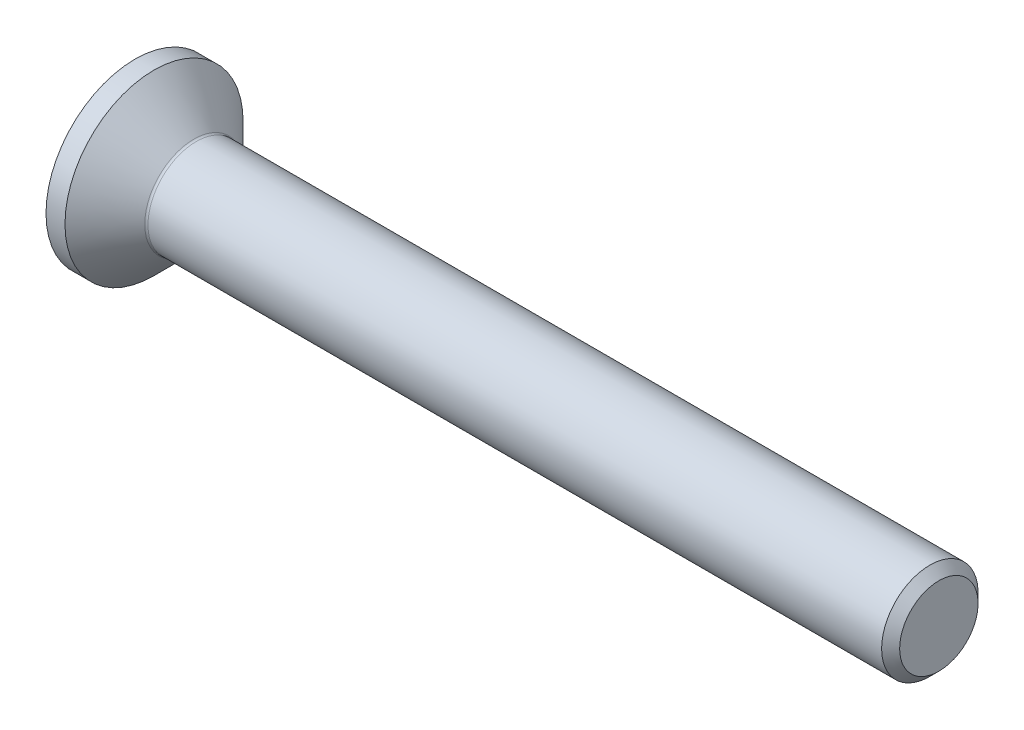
SolidWorks part; units mm, degrees
revolve "PreBroach" cut sketch "Sketch2"
sketch "Sketch2"
  line L0 (0, 1) -> (1.1, 1)
  line L1 (1.1, 1) -> (1.6774, 0)
  line L2 (0, 0) -> (127, 0) construction
  line L3 (1.6774, 0) -> (0, 0)
  line L4 (0, 0) -> (0, 1)
  line L5 (0, -1) -> (1.1, -1) construction
  line L6 (0, 0) -> (47.625, 0) construction
  line L8 (0, 2.77) -> (0, -2.77) construction
revolve "BaseBody" add sketch "BodySke"
sketch "BodySke" plane through (0, 0, 0) normal (0, 0, 1) x (1, 0, 0)
  line L0 (0, 0) -> (0, 2.77)
  line L1 (0.59, 2.77) -> (1.86, 1.5)
  line L2 (0, 2.77) -> (0.59, 2.77)
  line L3 (1.86, 1.5) -> (24.7195, 1.5)
  line L4 (25, 1.2195) -> (25, 0)
  line L5 (25, 0) -> (0, 0)
  line L6 (0, 0) -> (127, 0) construction
  line L7 (0.59, -2.77) -> (1.86, -1.5) construction
  line L8 (25, 1.2195) -> (24.7195, 1.5)
  line L9 (0, -2.77) -> (0.59, -2.77) construction
  line L10 (25, -1.2195) -> (24.7195, -1.5) construction
  line L11 (2.36, 7.85) -> (2.36, -14.375) construction
  line L12 (0, 19.05) -> (0, -3.175) construction
fillet "Fillet1" radius 0.1 1 edges at (1.86, 0, 1.5)
ref_plane "Plane1" through (0, 0, 0) normal (0, 0, 1) x (1, 0, 0)
ref_plane "Plane2" through (0, 0, 0) normal (0, 1, 0) x (1, 0, 0)
ref_plane "Plane3" through (0, 0, 0) normal (1, 0, 0) x (0, 0, -1)
other "Configuration Table"
sketch "Sketch3" plane through (0, 0, 0) normal (-1, 0, 0) x (0, 0, 1)
  line L0 (-1, -0.5774) -> (-1, 0.5774)
  line L1 (-1, 0.5774) -> (0, 1.1547)
  line L2 (0, 1.1547) -> (1, 0.5774)
  line L3 (1, 0.5774) -> (1, -0.5774)
  line L4 (1, -0.5774) -> (0, -1.1547)
  line L5 (0, -1.1547) -> (-1, -0.5774)
extrude "Hex" cut sketch "Sketch3" against normal blind 1.1
sketch "ThdSchSke" plane through (0, 0, 0) normal (0, 0, 1) x (1, 0, 0)
  line L0 (3.36, -1.2195) -> (3.1636, -1.5)
  line L1 (3.36, -1.2195) -> (3.5564, -1.5)
  line L2 (3.5564, -1.5) -> (3.5564, -1.875)
  line L3 (-3.175, 0) -> (5.1513, 0) construction
  line L4 (0, 2.77) -> (0, -2.77) construction
  line L5 (3.5564, -1.875) -> (3.1636, -1.875)
  line L6 (3.1636, -1.875) -> (3.1636, -1.5)
revolve "ThreadSchematic" [suppressed] cut sketch "ThdSchSke" angle 360 about L3
pattern_linear "ThdSchPat" [suppressed]
equation "\"Thread_minor@ThreadCosmetic\"  =  \"Minor_dia@BodySke\""
equation "\"D1@Sketch3\" = \"Hex_size@Sketch3\" / 2"
equation "\"D2@Sketch3\" = \"D1@Sketch3\""
equation "\"D3@Sketch3\" = \"Hex_size@Sketch3\""
equation "\"Thread_length@ThreadCosmetic\" = ((sgn( (\"Length@BodySke\" - \"Advance@BodySke\" * 3.0 - \"Head_ht@BodySke\" ) - \"Thread_nom@BodySke\" )-1)*( (\"Length@BodySke\" - \"Advance@BodySke\" * 3.0 - \"Head_ht@BodySke\" "
equation "\"Thread_minor@ThdSchSke\" = \"Minor_dia@BodySke\""
equation "\"Diameter@ThdSchSke\" = \"Diameter@BodySke\""
equation "\"Overcut@ThdSchSke\" = \"Diameter@BodySke\" * 1.25"
equation "\"Start@ThdSchSke\" = 0.000001 + \"Length@BodySke\" - \"Thread_length@ThreadCosmetic\"  '---Countersunk---"
equation "\"Num_threads@ThdSchPat\" = int( \"Thread_length@ThreadCosmetic\" / \"Advance@BodySke\" + 0.999 )  + 1"
equation "\"Advance@ThdSchPat\" = \"Thread_length@ThreadCosmetic\" /  (\"Num_threads@ThdSchPat\" - 1) 'relax it"
equation "\"Num_threads@ThdSchPat\" = \"Num_threads@ThdSchPat\" - sgn( \"Num_threads@ThdSchPat\" - 1) '---chamfered tips only---"
